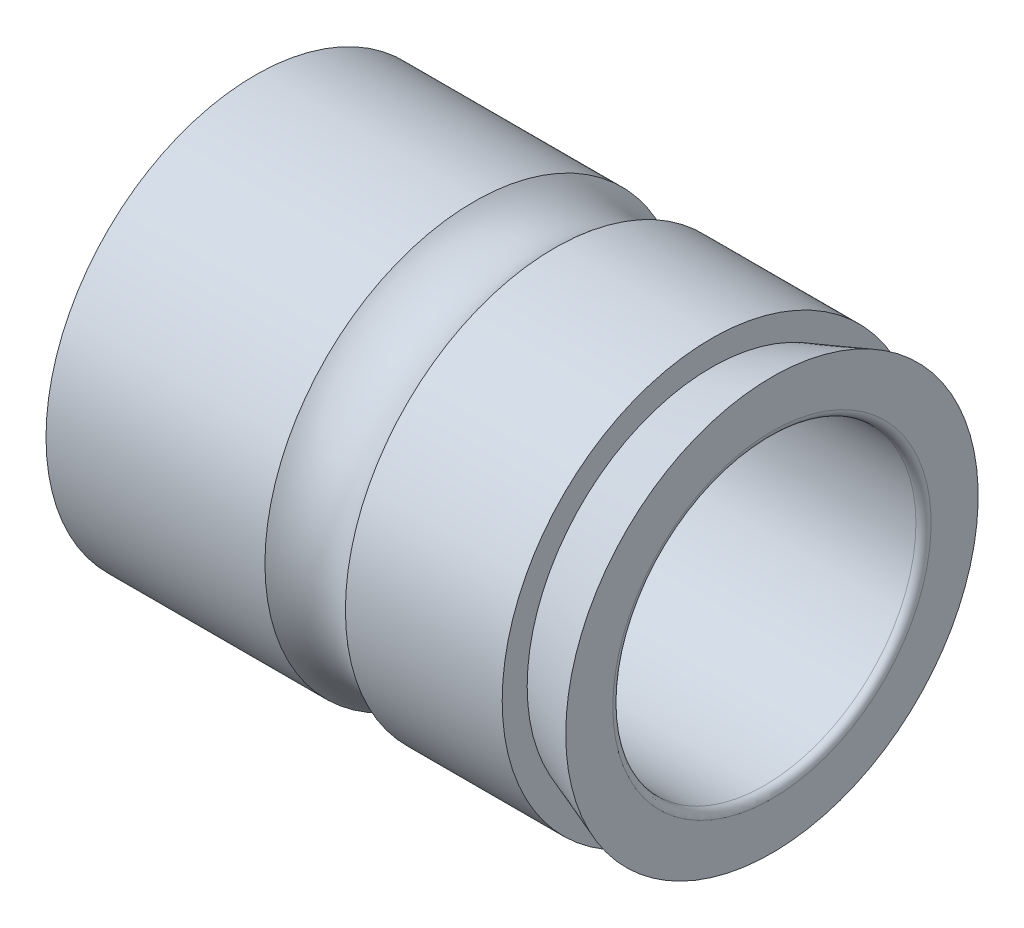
SolidWorks part; units mm, degrees
ref_plane "Front" through (0, 0, 0) normal (0, 0, 1) x (1, 0, 0)
ref_plane "Top" through (0, 0, 0) normal (0, 1, 0) x (1, 0, 0)
ref_plane "Right" through (0, 0, 0) normal (1, 0, 0) x (0, 0, -1)
sketch "Esquisse1" plane through (0, 0, 0) normal (0, 0, 1) x (1, 0, 0)
  line L0 (-23.247, 52.5) -> (22.03, 52.5) construction
  line L2 (-17.1, 66.3) -> (-17.1, 63)
  line L4 (-2.6553, 66.3) -> (-17.1, 66.3)
  line L6 (13, 66.3) -> (2.6553, 66.3)
  line L8 (13, 64.65) -> (13, 66.3)
  line L10 (17, 66.1059) -> (13, 64.65)
  line L12 (17, 63) -> (17, 66.1059)
  line L15 (16.5, 62.5) -> (-16.6, 62.5)
  arc A1 (-2.6553, 66.3) -> (2.6553, 66.3) centre (0, 69.25) ccw
  arc A3 (16.5, 62.5) -> (17, 63) centre (16.5, 63) ccw
  arc A5 (-17.1, 63) -> (-16.6, 62.5) centre (-16.6, 63) ccw
revolve "Révolution1" add sketch "Esquisse1" angle 360 about L0
